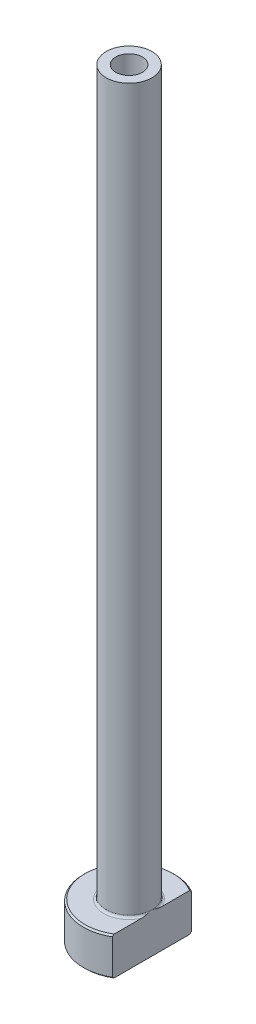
SolidWorks part; units mm, degrees
ref_plane "Front Plane" through (0, 0, 0) normal (0, 0, 1) x (1, 0, 0)
ref_plane "Top Plane" through (0, 0, 0) normal (0, 1, 0) x (1, 0, 0)
ref_plane "Right Plane" through (0, 0, 0) normal (1, 0, 0) x (0, 0, -1)
sketch "Sketch1" plane through (0, 0, 0) normal (0, 0, 1) x (1, 0, 0)
  line L0 (-1.75, 100) -> (-3, 100)
  line L1 (-3, 100) -> (-3, 5)
  line L2 (-3, 5) -> (-6, 5)
  line L3 (-6, 5) -> (-6, 0)
  line L4 (4.125, 0) -> (-4.125, 0) construction
  line L5 (-6, 0) -> (-2, 0)
  line L6 (-1.75, 55) -> (-1.75, 100)
  line L7 (0, 92.1877) -> (0, -15.5353) construction
  line L8 (0, -5.5) -> (0, 5.5) construction
  line L9 (-1.75, 55) -> (-2, 43)
  line L10 (-2, 43) -> (-2, 0)
  dimension "D1" = 0.25
  dimension "ID" = 3.5
  dimension "OD" = 6
  dimension "L" = 100
  dimension "H" = 12
  dimension "T" = 5
  dimension "N" = 45
  dimension "D2" = 12
  dimension "L-N" = 55
revolve "Revolve1" add sketch "Sketch1" angle 360 about L7
fillet "Fillet1" radius 0.3 1 edges at (0, 5, 3)
chamfer "Chamfer1" distance 0.2 angle 45 2 edges at (0, 5, 6) (0, 0, 6)
sketch "Sketch2" plane through (0, 0, 0) normal (0, -1, 0) x (1, 0, 0)
  line L0 (3, 5.1962) -> (3, -5.1962)
  circle A0 centre (0, 0) radius 6 construction
  arc A1 (3, 5.1962) -> (3, -5.1962) centre (0, 0) cw
  circle A2 centre (0, 0) radius 3 construction
extrude "Cut-Extrude1" cut sketch "Sketch2" against normal through all
chamfer "Chamfer2" distance 0.5 angle 45 1 edges at (0, 0, 2)
